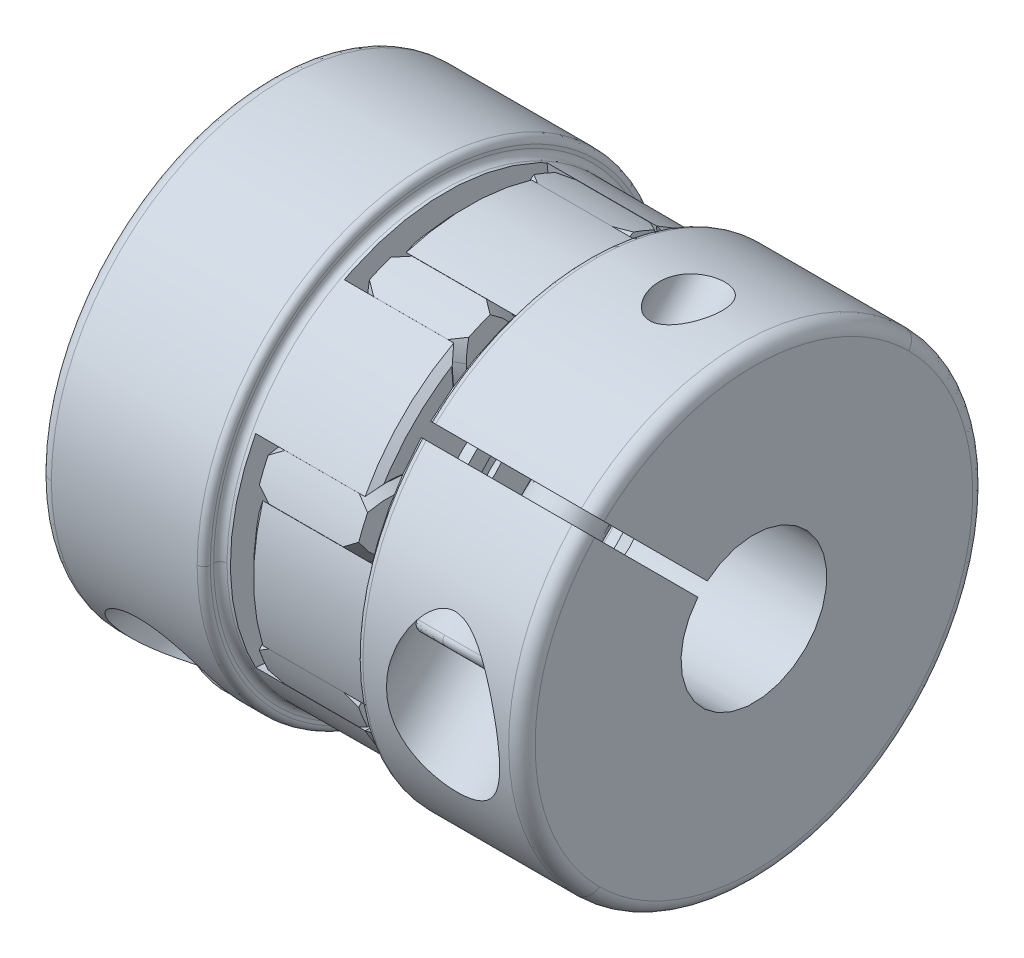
SolidWorks part; units mm, degrees
ref_plane "Front Plane" through (0, 0, 0) normal (0, 0, 1) x (1, 0, 0)
ref_plane "Top Plane" through (0, 0, 0) normal (0, 1, 0) x (1, 0, 0)
ref_plane "Right Plane" through (0, 0, 0) normal (1, 0, 0) x (0, 0, -1)
imported_body "Imported1"
sketch "Sketch1" plane through (29, 0, 0) normal (-1, 0, 0) x (0, 0, 1)
  arc A2 (-31.0907, 9.4665) -> (-20.0513, 2.8301) centre (-18.2787, 18.2787) ccw construction
  arc A3 (-20.0513, 2.8301) -> (-20.0513, -2.8301) centre (0, 0) ccw construction
  arc A7 (-20.0513, -2.8301) -> (-31.0907, -9.4665) centre (-18.2787, -18.2787) ccw construction
  arc A8 (-31.0907, 9.4665) -> (-20.0513, 2.8301) centre (-18.2787, 18.2787) ccw
  arc A9 (-20.0513, 2.8301) -> (-20.0513, -2.8301) centre (0, 0) ccw
  arc A10 (-20.0513, -2.8301) -> (-31.0907, -9.4665) centre (-18.2787, -18.2787) ccw
  arc A12 (-15.2906, 28.6783) -> (-12.1772, 16.1795) centre (0, 25.85) ccw construction
  arc A13 (-16.1795, 12.1772) -> (-28.6783, 15.2906) centre (-25.85, 0) ccw construction
  arc A14 (-15.2906, 28.6783) -> (-12.1772, 16.1795) centre (0, 25.85) ccw
  arc A15 (-16.1795, 12.1772) -> (-28.6783, 15.2906) centre (-25.85, 0) ccw
  arc A16 (2.8301, 20.0513) -> (-2.8301, 20.0513) centre (0, 0) ccw construction
  arc A17 (9.4665, 31.0907) -> (2.8301, 20.0513) centre (18.2787, 18.2787) ccw construction
  arc A18 (-2.8301, 20.0513) -> (-9.4665, 31.0907) centre (-18.2787, 18.2787) ccw construction
  arc A19 (2.8301, 20.0513) -> (-2.8301, 20.0513) centre (0, 0) ccw
  arc A20 (9.4665, 31.0907) -> (2.8301, 20.0513) centre (18.2787, 18.2787) ccw
  arc A21 (-2.8301, 20.0513) -> (-9.4665, 31.0907) centre (-18.2787, 18.2787) ccw
  arc A22 (31.0907, -9.4665) -> (20.0513, -2.8301) centre (18.2787, -18.2787) ccw construction
  arc A23 (20.0513, 2.8301) -> (31.0907, 9.4665) centre (18.2787, 18.2787) ccw construction
  arc A24 (20.0513, -2.8301) -> (20.0513, 2.8301) centre (0, 0) ccw construction
  arc A25 (31.0907, -9.4665) -> (20.0513, -2.8301) centre (18.2787, -18.2787) ccw
  arc A26 (20.0513, 2.8301) -> (31.0907, 9.4665) centre (18.2787, 18.2787) ccw
  arc A27 (20.0513, -2.8301) -> (20.0513, 2.8301) centre (0, 0) ccw
  arc A28 (-9.4665, -31.0907) -> (-2.8301, -20.0513) centre (-18.2787, -18.2787) ccw construction
  arc A29 (-2.8301, -20.0513) -> (2.8301, -20.0513) centre (0, 0) ccw construction
  arc A30 (2.8301, -20.0513) -> (9.4665, -31.0907) centre (18.2787, -18.2787) ccw construction
  arc A31 (-9.4665, -31.0907) -> (-2.8301, -20.0513) centre (-18.2787, -18.2787) ccw
  arc A32 (-2.8301, -20.0513) -> (2.8301, -20.0513) centre (0, 0) ccw
  arc A33 (2.8301, -20.0513) -> (9.4665, -31.0907) centre (18.2787, -18.2787) ccw
  arc A34 (-12.1772, -16.1795) -> (-15.2906, -28.6783) centre (0, -25.85) ccw construction
  arc A35 (-16.1795, -12.1772) -> (-12.1772, -16.1795) centre (0, 0) ccw construction
  arc A36 (-28.6783, -15.2906) -> (-16.1795, -12.1772) centre (-25.85, 0) ccw construction
  arc A37 (-12.1772, -16.1795) -> (-15.2906, -28.6783) centre (0, -25.85) ccw
  arc A38 (-16.1795, -12.1772) -> (-12.1772, -16.1795) centre (0, 0) ccw
  arc A39 (-28.6783, -15.2906) -> (-16.1795, -12.1772) centre (-25.85, 0) ccw
  arc A40 (16.1795, -12.1772) -> (28.6783, -15.2906) centre (25.85, 0) ccw construction
  arc A41 (12.1772, -16.1795) -> (16.1795, -12.1772) centre (0, 0) ccw construction
  arc A42 (15.2906, -28.6783) -> (12.1772, -16.1795) centre (0, -25.85) ccw construction
  arc A43 (16.1795, -12.1772) -> (28.6783, -15.2906) centre (25.85, 0) ccw
  arc A44 (12.1772, -16.1795) -> (16.1795, -12.1772) centre (0, 0) ccw
  arc A45 (15.2906, -28.6783) -> (12.1772, -16.1795) centre (0, -25.85) ccw
  arc A46 (28.6783, 15.2906) -> (16.1795, 12.1772) centre (25.85, 0) ccw construction
  arc A47 (12.1772, 16.1795) -> (15.2906, 28.6783) centre (0, 25.85) ccw construction
  arc A48 (16.1795, 12.1772) -> (12.1772, 16.1795) centre (0, 0) ccw construction
  arc A49 (28.6783, 15.2906) -> (16.1795, 12.1772) centre (25.85, 0) ccw
  arc A50 (12.1772, 16.1795) -> (15.2906, 28.6783) centre (0, 25.85) ccw
  arc A51 (16.1795, 12.1772) -> (12.1772, 16.1795) centre (0, 0) ccw
  arc A52 (-28.6783, 15.2906) -> (-31.0907, 9.4665) centre (0, 0) ccw
  arc A53 (-31.0907, -9.4665) -> (-28.6783, -15.2906) centre (0, 0) ccw
  arc A54 (-15.2906, -28.6783) -> (-9.4665, -31.0907) centre (0, 0) ccw
  arc A55 (9.4665, -31.0907) -> (15.2906, -28.6783) centre (0, 0) ccw
  arc A56 (28.6783, -15.2906) -> (31.0907, -9.4665) centre (0, 0) ccw
  arc A57 (31.0907, 9.4665) -> (28.6783, 15.2906) centre (0, 0) ccw
  arc A58 (15.2906, 28.6783) -> (9.4665, 31.0907) centre (0, 0) ccw
  arc A59 (-9.4665, 31.0907) -> (-15.2906, 28.6783) centre (0, 0) ccw
extrude "Cut-Extrude-Thin6" cut sketch "Sketch1" against normal up to surface (15 mm away) thin
